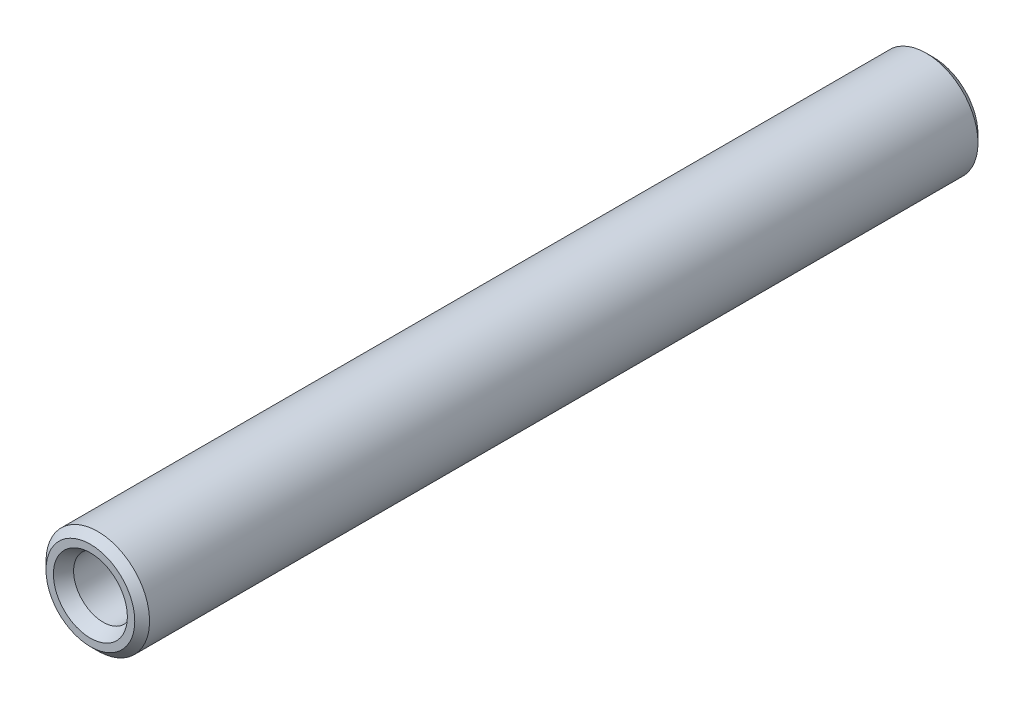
SolidWorks part; units mm, degrees
ref_plane "Přední rovina" through (0, 0, 0) normal (0, 0, 1) x (1, 0, 0)
ref_plane "Horní rovina" through (0, 0, 0) normal (0, 1, 0) x (1, 0, 0)
ref_plane "Pravá rovina" through (0, 0, 0) normal (1, 0, 0) x (0, 0, -1)
sketch "Skica1" plane through (0, 0, 0) normal (0, 0, 1) x (1, 0, 0)
  circle A1 centre (0, 0) radius 7
  dimension "D1" = 14
extrude "Přidat vysunutím1" add sketch "Skica1" along normal blind 114
sketch "Skica2" plane through (0, 0, 114) normal (0, 0, 1) x (1, 0, 0)
  circle A0 centre (0, 0) radius 4
  dimension "D1" = 8
extrude "Odebrat vysunutím1" cut sketch "Skica2" against normal blind 15
sketch "Skica3" plane through (0, 0, 0) normal (0, 0, -1) x (-1, 0, 0)
  circle A0 centre (0, 0) radius 4
  dimension "D1" = 8
extrude "Odebrat vysunutím2" cut sketch "Skica3" against normal blind 15
chamfer "Zkosení1" distance 1 angle 45 2 edges at (7, 0, 0) (7, 0, 114)
chamfer "Zkosení2" distance 1 angle 60 2 edges at (4, 0, 114) (-4, 0, 0)
